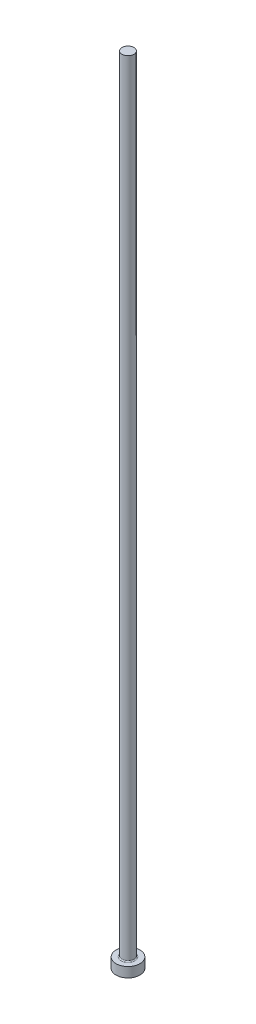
SolidWorks part; units mm, degrees
ref_plane "Plano frontal" through (0, 0, 0) normal (0, 0, 1) x (1, 0, 0)
ref_plane "Plano superior" through (0, 0, 0) normal (0, 1, 0) x (1, 0, 0)
ref_plane "Plano direito" through (0, 0, 0) normal (1, 0, 0) x (0, 0, -1)
sketch "Esboço1" plane through (0, 0, 0) normal (0, 0, 1) x (1, 0, 0)
  line L0 (0, 0) -> (6, 0)
  line L1 (6, 0) -> (6, 5)
  line L2 (6, 5) -> (3.5, 5)
  line L3 (3, 5.5) -> (3, 400)
  line L4 (3, 400) -> (0, 400)
  line L5 (0, 400) -> (0, 0) construction
  line L6 (0, 0) -> (0, 400)
  arc A0 (3.5, 5) -> (3, 5.5) centre (3.5, 5.5) cw
  dimension "D3" = 0.5
  dimension "D1" = 12
  dimension "D2" = 6
  dimension "D4" = 5
  dimension "D5" = 400
revolve "Revolução1" add sketch "Esboço1" angle 360 about L5
sketch "Esboço2"
  dimension "D1" = 3.225
  dimension "D2" = 1.05
  dimension "D3" = 0.675
  dimension "D4" = 0.45
wrap "Envolver1" sketch "Esboço2" wrap type deboss source sketch "Esboço2" thickness 0.1 parameters "D1"=0.1
